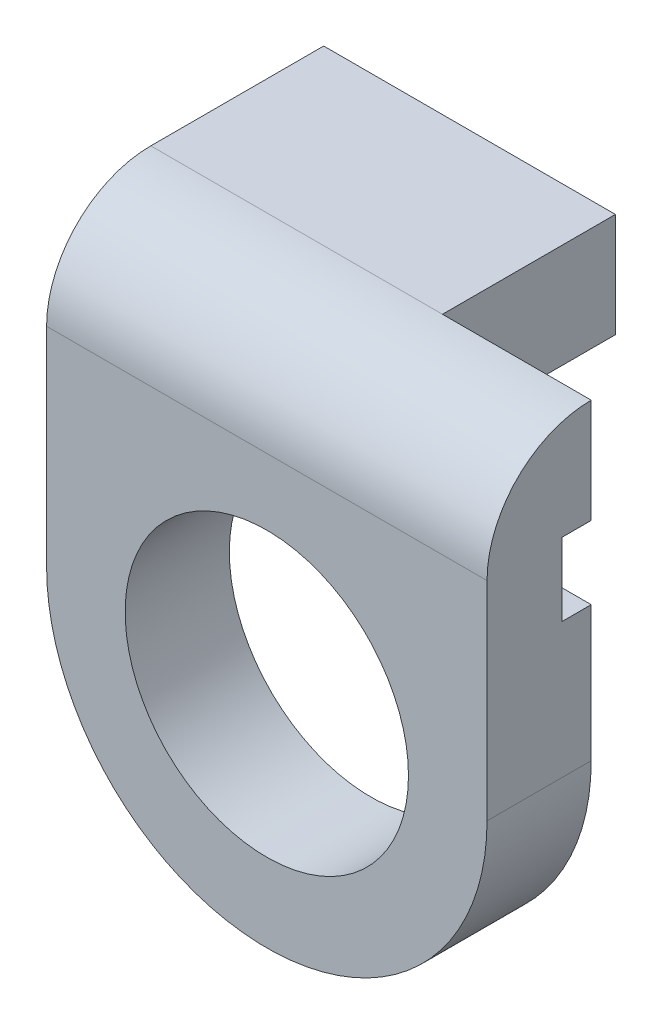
SolidWorks part; units mm, degrees
ref_plane "Plan1" through (0, 0, 0) normal (0, 0, 1) x (1, 0, 0)
ref_plane "Plan2" through (0, 0, 0) normal (0, 1, 0) x (1, 0, 0)
ref_plane "Plan3" through (0, 0, 0) normal (1, 0, 0) x (0, 0, -1)
sketch "Esquisse1" plane through (0, 0, 0) normal (0, 0, 1) x (1, 0, 0)
  line L0 (-37.6881, 225.2147) -> (-37.6881, 210.2285)
  line L1 (-58.8268, 210.2285) -> (-58.8268, 225.2147)
  line L2 (-58.8268, 225.2147) -> (-37.6881, 225.2147)
  arc A0 (-37.6881, 210.2285) -> (-58.8268, 210.2285) centre (-48.2575, 210.2285) cw
  circle A1 centre (-48.2575, 210.2285) radius 6.7987
extrude "Base-Extrusion" add sketch "Esquisse1" against normal blind 5
sketch "Esquisse4" plane through (0, 0, -5) normal (0, 0, -1) x (-1, 0, 0)
  line L0 (58.8268, 225.2147) -> (58.8268, 220.2147)
  line L1 (58.8268, 225.2147) -> (58.8268, 210.2285) construction
  line L2 (58.8268, 220.2147) -> (44.8268, 220.2147)
  line L3 (44.8268, 220.2147) -> (44.8268, 225.2147)
  line L4 (58.8268, 225.2147) -> (44.8268, 225.2147)
  dimension "D1" = 5
  dimension "D2" = 14
extrude "Boss.-Extru.1" add sketch "Esquisse4" along normal blind 8.3
sketch "Esquisse5" plane through (-58.8268, 0, 0) normal (-1, 0, 0) x (0, 0, 1)
  line L0 (-5, 220.2147) -> (-5, 210.2285) construction
  line L1 (-5, 220.2147) -> (-3.6, 220.2147)
  line L2 (-5, 220.2147) -> (-5, 216.7147)
  line L3 (-5, 216.7147) -> (-3.6, 216.7147)
  line L4 (-3.6, 220.2147) -> (-3.6, 216.7147)
  line L5 (-13.3, 220.2147) -> (-5, 220.2147) construction
  dimension "D1" = 1.4
  dimension "D2" = 3.5
extrude "Enlèv. mat.-Extru.1" cut sketch "Esquisse5" against normal through all
fillet "Congé1" radius 5
